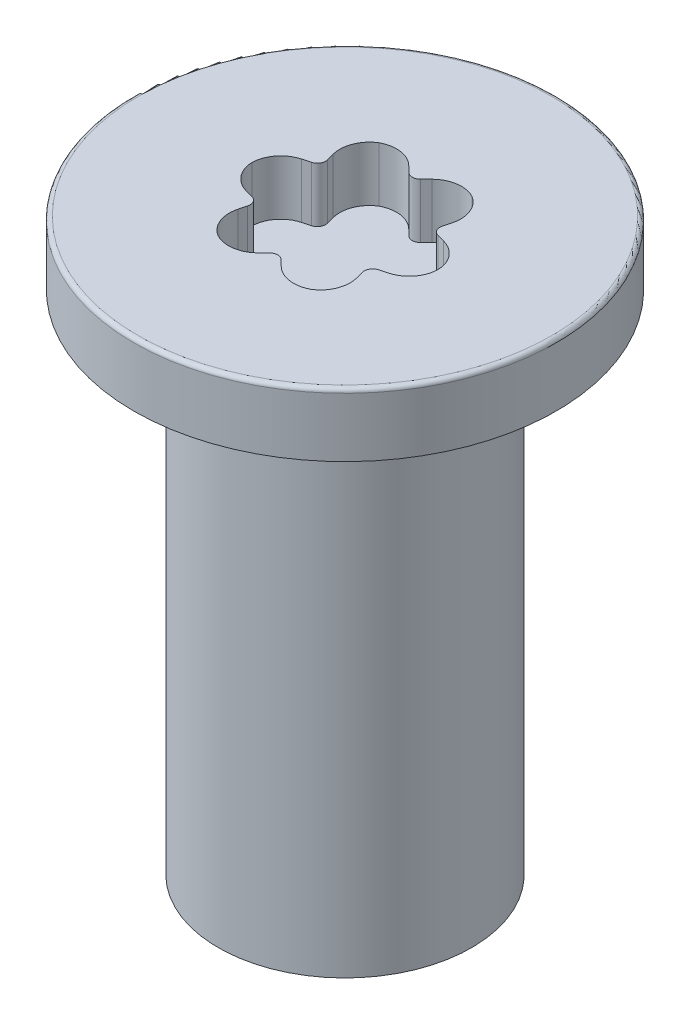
SolidWorks part; units mm, degrees
ref_plane "Aufriss" through (0, 0, 0) normal (0, 0, 1) x (1, 0, 0)
ref_plane "Grundriss" through (0, 0, 0) normal (0, 1, 0) x (1, 0, 0)
ref_plane "Seitenriss" through (0, 0, 0) normal (1, 0, 0) x (0, 0, -1)
sketch "Skizze1" plane through (0, 0, 0) normal (0, 0, 1) x (1, 0, 0)
  line L0 (0, 0) -> (-3, 0)
  line L1 (-3, 0) -> (-3, 12)
  line L2 (-3, 12) -> (-5, 12)
  line L3 (-5, 12) -> (-5, 13.4)
  line L4 (-4.9, 13.5) -> (0, 13.5)
  line L5 (0, 0) -> (0, 13.5) construction
  line L6 (0, 0) -> (0, 13.5)
  arc A0 (-5, 13.4) -> (-4.9, 13.5) centre (-4.9, 13.4) cw
  dimension "D1" = 6
  dimension "D5" = 0.1
  dimension "D2" = 10
  dimension "D3" = 12
  dimension "D4" = 1.5
revolve "Rotation1" add sketch "Skizze1" angle 360 about L5
sketch "Skizze3" plane through (0, 13.5, 0) normal (0, 1, 0) x (1, 0, 0)
  line L0 (-0.6051, 2.1151) -> (0, 1.51)
  line L1 (0, 1.51) -> (0.6051, 2.1151)
  line L2 (0, 0) -> (0, 2.2) construction
  line L3 (1.3077, 0.755) -> (2.1343, 0.5335)
  line L4 (1.5292, 1.5816) -> (1.3077, 0.755)
  line L5 (1.3077, -0.755) -> (1.5292, -1.5816)
  line L6 (2.1343, -0.5335) -> (1.3077, -0.755)
  line L7 (0, -1.51) -> (-0.6051, -2.1151)
  line L8 (0.6051, -2.1151) -> (0, -1.51)
  line L9 (-1.3077, -0.755) -> (-2.1343, -0.5335)
  line L10 (-1.5292, -1.5816) -> (-1.3077, -0.755)
  line L11 (-1.3077, 0.755) -> (-1.5292, 1.5816)
  line L12 (-2.1343, 0.5335) -> (-1.3077, 0.755)
  circle A0 centre (0, 0) radius 2.2
  point P23 (-0.3873, 0.2184)
  point P25 (0, 0)
  dimension "D1" = 4.4
  dimension "D2" = 45
  dimension "D3" = 6
  dimension "D4" = 1.51
extrude "Schnitt-Linear austragen2" cut sketch "Skizze3" against normal blind 1.3
fillet "Verrundung1" radius 0.7 12 edges at (-2.1343, 12.85, -0.5335) (-2.1343, 12.85, 0.5335) (-1.5292, 12.85, 1.5816) (-0.6051, 12.85, 2.1151) (0.6051, 12.85, 2.1151) (1.5292, 12.85, 1.5816) (2.1343, 12.85, 0.5335) (2.1343, 12.85, -0.5335) (1.5292, 12.85, -1.5816) (0.6051, 12.85, -2.1151) (-0.6051, 12.85, -2.1151) (-1.5292, 12.85, -1.5816)
fillet "Verrundung2" radius 0.2 6 edges at (-1.3077, 12.85, 0.755) (0, 12.85, 1.51) (1.3077, 12.85, 0.755) (1.3077, 12.85, -0.755) (0, 12.85, -1.51) (-1.3077, 12.85, -0.755)
